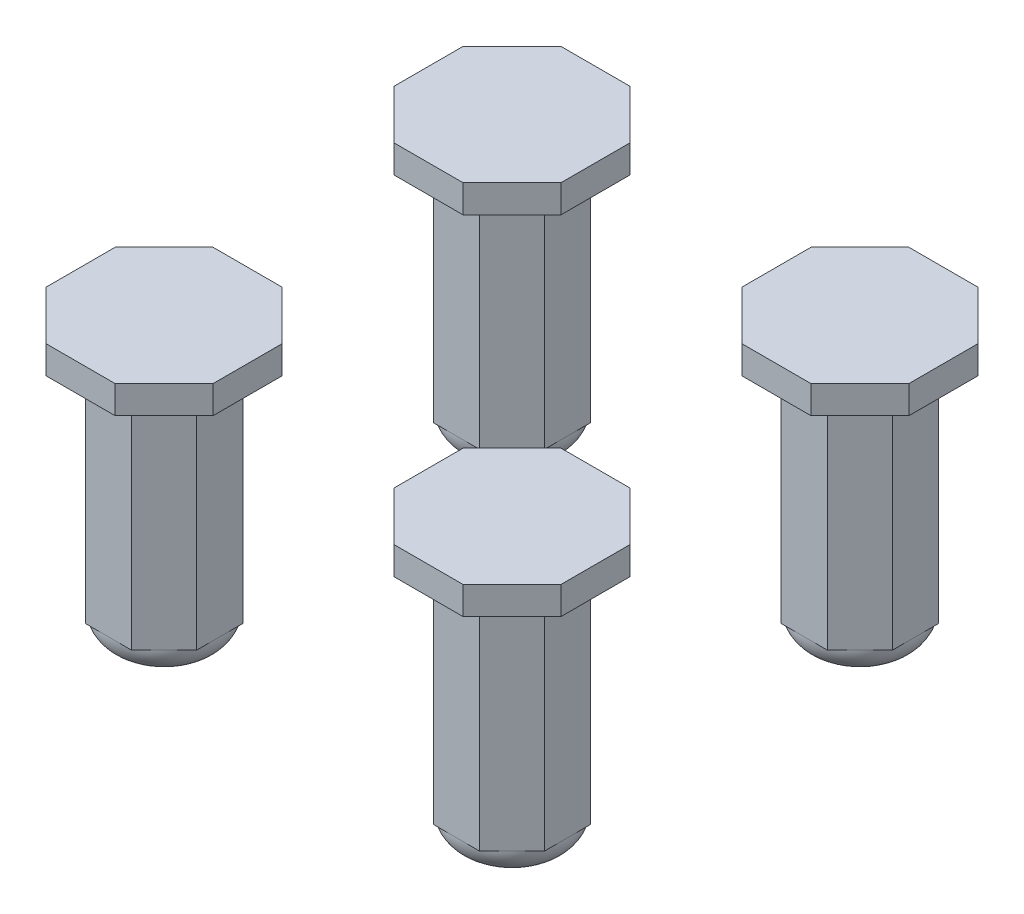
SolidWorks part; units mm, degrees
ref_plane "Plan de face" through (0, 0, 0) normal (0, 0, 1) x (1, 0, 0)
ref_plane "Plan de dessus" through (0, 0, 0) normal (0, 1, 0) x (1, 0, 0)
ref_plane "Plan de droite" through (0, 0, 0) normal (1, 0, 0) x (0, 0, -1)
sketch "Esquisse1" plane through (0, 0, 0) normal (0, 1, 0) x (1, 0, 0)
  line L25 (0.1657, 0.4) -> (-0.1657, 0.4)
  line L26 (-0.1657, 0.4) -> (-0.4, 0.1657)
  line L27 (-0.4, 0.1657) -> (-0.4, -0.1657)
  line L28 (-0.4, -0.1657) -> (-0.1657, -0.4)
  line L29 (-0.1657, -0.4) -> (0.1657, -0.4)
  line L30 (0.1657, -0.4) -> (0.4, -0.1657)
  line L31 (0.4, -0.1657) -> (0.4, 0.1657)
  line L32 (0.4, 0.1657) -> (0.1657, 0.4)
  line L33 (2.6657, 0.4) -> (2.3343, 0.4)
  line L34 (2.3343, 0.4) -> (2.1, 0.1657)
  line L35 (2.1, 0.1657) -> (2.1, -0.1657)
  line L36 (2.1, -0.1657) -> (2.3343, -0.4)
  line L37 (2.3343, -0.4) -> (2.6657, -0.4)
  line L38 (2.6657, -0.4) -> (2.9, -0.1657)
  line L39 (2.9, -0.1657) -> (2.9, 0.1657)
  line L40 (2.9, 0.1657) -> (2.6657, 0.4)
  line L41 (0.1657, -2.1) -> (-0.1657, -2.1)
  line L42 (-0.1657, -2.1) -> (-0.4, -2.3343)
  line L43 (-0.4, -2.3343) -> (-0.4, -2.6657)
  line L44 (-0.4, -2.6657) -> (-0.1657, -2.9)
  line L45 (-0.1657, -2.9) -> (0.1657, -2.9)
  line L46 (0.1657, -2.9) -> (0.4, -2.6657)
  line L47 (0.4, -2.6657) -> (0.4, -2.3343)
  line L48 (0.4, -2.3343) -> (0.1657, -2.1)
  line L49 (2.6657, -2.1) -> (2.3343, -2.1)
  line L50 (2.3343, -2.1) -> (2.1, -2.3343)
  line L51 (2.1, -2.3343) -> (2.1, -2.6657)
  line L52 (2.1, -2.6657) -> (2.3343, -2.9)
  line L53 (2.3343, -2.9) -> (2.6657, -2.9)
  line L54 (2.6657, -2.9) -> (2.9, -2.6657)
  line L55 (2.9, -2.6657) -> (2.9, -2.3343)
  line L56 (2.9, -2.3343) -> (2.6657, -2.1)
  circle A4 centre (0, 0) radius 0.4 construction
  circle A5 centre (2.5, 0) radius 0.4 construction
  circle A6 centre (0, -2.5) radius 0.4 construction
  circle A7 centre (2.5, -2.5) radius 0.4 construction
  dimension "D1" = 0.8
  dimension "D2" = 2.5
  dimension "D3" = 2.5
extrude "Boss.-Extru.1" add sketch "Esquisse1" along normal blind 1.6
sketch "Esquisse2" plane through (0, 1.6, 0) normal (0, 1, 0) x (1, 0, 0)
  line L1 (-0.2485, 0.6) -> (-0.6, 0.2485)
  line L2 (-0.6, 0.2485) -> (-0.6, -0.2485)
  line L3 (-0.6, -0.2485) -> (-0.2485, -0.6)
  line L4 (-0.2485, -0.6) -> (0.2485, -0.6)
  line L5 (0.2485, -0.6) -> (0.6, -0.2485)
  line L6 (0.6, -0.2485) -> (0.6, 0.2485)
  line L7 (0.6, 0.2485) -> (0.2485, 0.6)
  line L8 (0.2485, 0.6) -> (-0.2485, 0.6)
  line L9 (2.7485, 0.6) -> (2.2515, 0.6)
  line L10 (2.2515, 0.6) -> (1.9, 0.2485)
  line L11 (1.9, 0.2485) -> (1.9, -0.2485)
  line L12 (1.9, -0.2485) -> (2.2515, -0.6)
  line L13 (2.2515, -0.6) -> (2.7485, -0.6)
  line L14 (2.7485, -0.6) -> (3.1, -0.2485)
  line L15 (3.1, -0.2485) -> (3.1, 0.2485)
  line L16 (3.1, 0.2485) -> (2.7485, 0.6)
  line L17 (0.2485, -1.9) -> (-0.2485, -1.9)
  line L18 (-0.2485, -1.9) -> (-0.6, -2.2515)
  line L19 (-0.6, -2.2515) -> (-0.6, -2.7485)
  line L20 (-0.6, -2.7485) -> (-0.2485, -3.1)
  line L21 (-0.2485, -3.1) -> (0.2485, -3.1)
  line L22 (0.2485, -3.1) -> (0.6, -2.7485)
  line L23 (0.6, -2.7485) -> (0.6, -2.2515)
  line L24 (0.6, -2.2515) -> (0.2485, -1.9)
  line L25 (2.7485, -1.9) -> (2.2515, -1.9)
  line L26 (2.2515, -1.9) -> (1.9, -2.2515)
  line L27 (1.9, -2.2515) -> (1.9, -2.7485)
  line L28 (1.9, -2.7485) -> (2.2515, -3.1)
  line L29 (2.2515, -3.1) -> (2.7485, -3.1)
  line L30 (2.7485, -3.1) -> (3.1, -2.7485)
  line L31 (3.1, -2.7485) -> (3.1, -2.2515)
  line L32 (3.1, -2.2515) -> (2.7485, -1.9)
  circle A0 centre (0, 0) radius 0.6 construction
  circle A1 centre (2.5, 0) radius 0.6 construction
  circle A2 centre (0, -2.5) radius 0.6 construction
  circle A3 centre (2.5, -2.5) radius 0.6 construction
  dimension "D1" = 1.2
  dimension "D2" = 2.5
  dimension "D3" = 2.5
extrude "Boss.-Extru.2" add sketch "Esquisse2" along normal blind 0.2
sketch "Esquisse3" plane through (0, 0, 0) normal (0, -1, 0) x (1, 0, 0)
  circle A0 centre (0, 2.5) radius 0.4
  circle A1 centre (2.5, 2.5) radius 0.4
  circle A2 centre (0, 0) radius 0.4
  circle A3 centre (2.5, 0) radius 0.4
extrude "Boss.-Extru.3" add sketch "Esquisse3" along normal blind 0.2
fillet "Congé2" radius 0.2 1 edges at (0, -0.2, 2.1)
fillet "Congé3" radius 0.2 1 edges at (2.5, -0.2, 2.1)
fillet "Congé4" radius 0.2 1 edges at (0, -0.2, -0.4)
fillet "Congé5" radius 0.2 1 edges at (2.5, -0.2, -0.4)
